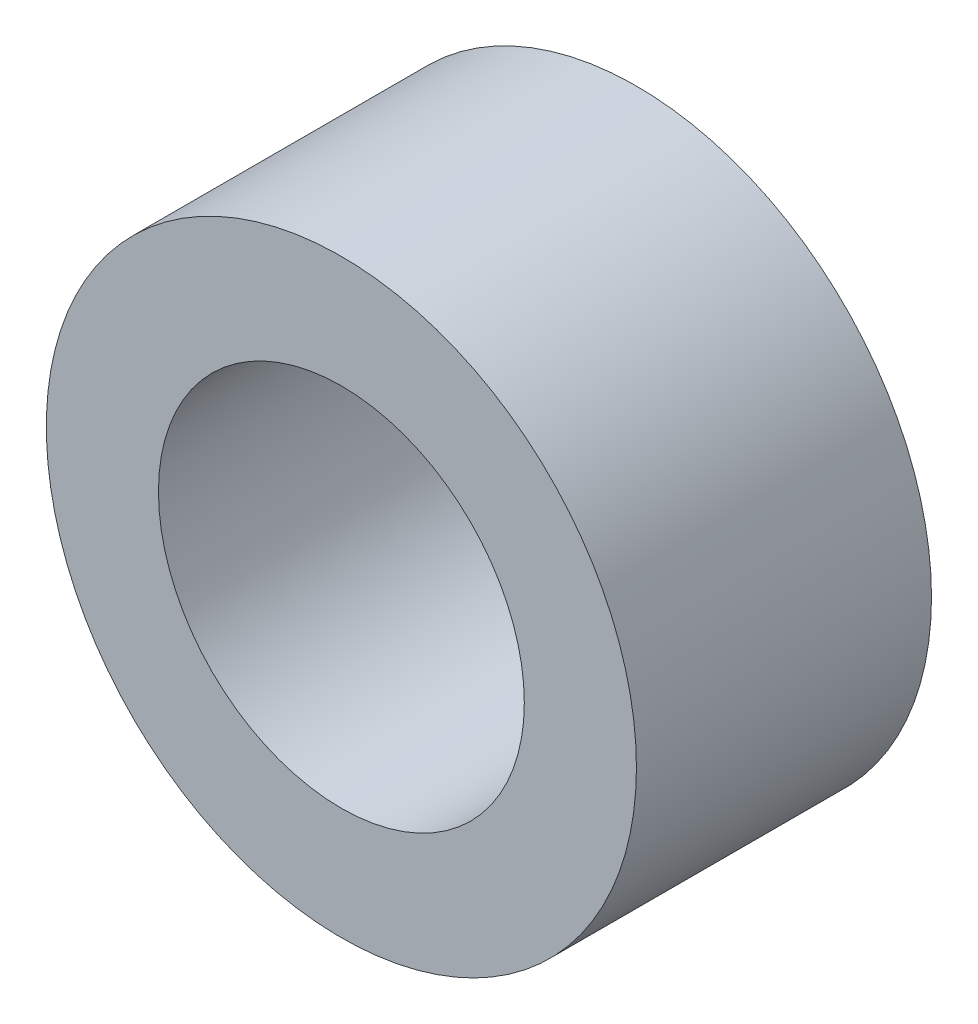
SolidWorks part; units mm, degrees
ref_plane "前视基准面" through (0, 0, 0) normal (0, 0, 1) x (1, 0, 0)
ref_plane "上视基准面" through (0, 0, 0) normal (0, 1, 0) x (1, 0, 0)
ref_plane "右视基准面" through (0, 0, 0) normal (1, 0, 0) x (0, 0, -1)
other "Configuration Table"
sketch "草图1" plane through (0, 0, 0) normal (0, 0, 1) x (1, 0, 0)
  circle A0 centre (0, 0) radius 5
  circle A1 centre (0, 0) radius 3.1
  dimension "D1" = 6.2
  dimension "D2" = 10
extrude "Flanged_Pivot_Bush_Envelope" add sketch "草图1" against normal mid plane 5
